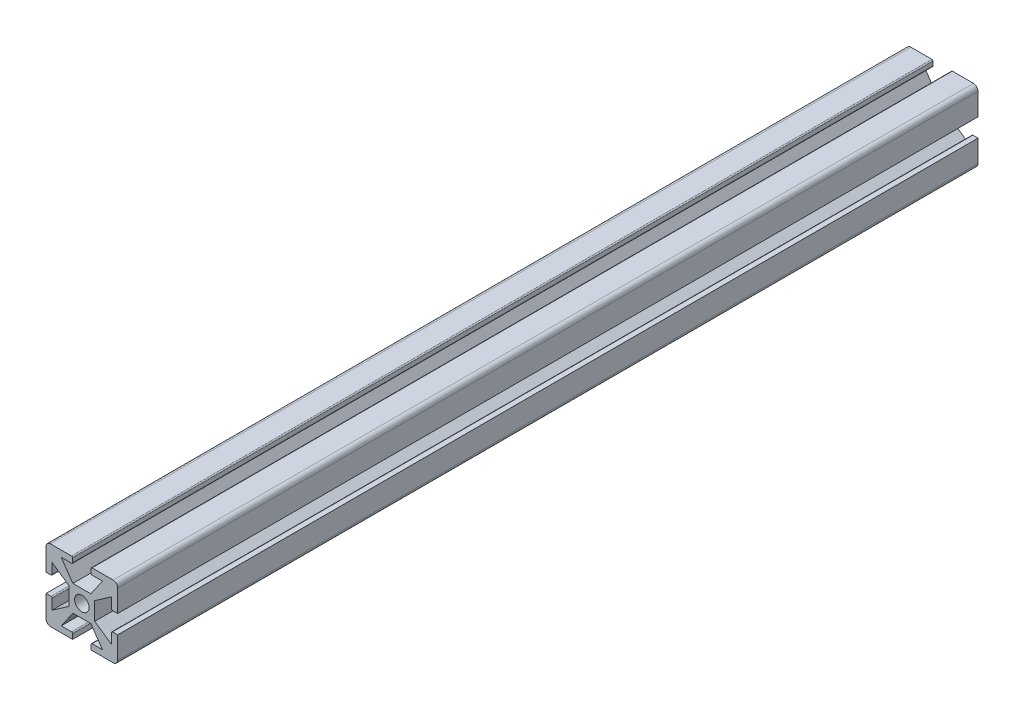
SolidWorks part; units mm, degrees
ref_plane "Front Plane" through (0, 0, 0) normal (0, 0, 1) x (1, 0, 0)
ref_plane "Top Plane" through (0, 0, 0) normal (0, 1, 0) x (1, 0, 0)
ref_plane "Right Plane" through (0, 0, 0) normal (1, 0, 0) x (0, 0, -1)
sketch "Sketch1" plane through (0, 0, 0) normal (0, 0, 1) x (1, 0, 0)
  line L1 (-12.7, -12.7) -> (12.7, -12.7)
  line L2 (-12.7, -12.7) -> (-12.7, 12.7)
  line L3 (-12.7, 12.7) -> (12.7, 12.7)
  line L4 (12.7, -12.7) -> (12.7, 12.7)
  line L5 (-12.7, -12.7) -> (12.7, 12.7) construction
  line L6 (-12.7, 12.7) -> (12.7, -12.7) construction
  point P0 (0, 0)
extrude "Boss-Extrude1" add sketch "Sketch1" along normal blind 304.8
fillet "Fillet1" radius 1.5875 4 edges at (-12.7, -12.7, 152.4) (12.7, -12.7, 152.4) (-12.7, 12.7, 152.4) (12.7, 12.7, 152.4)
other "Hole1"
sketch "Sketch6" plane through (0, 0, 304.8) normal (0, 0, 1) x (1, 0, 0)
  circle A0 centre (0, -0.0488) radius 2.5527
  dimension "D1" = 5.1054
sketch "Sketch7" plane through (0, 0, 304.8) normal (0, 0, 1) x (1, 0, 0)
  line L0 (11.1125, 12.7) -> (-11.1125, 12.7) construction
  line L1 (-3.2639, 10.4648) -> (3.2639, 10.4648) construction
  line L2 (-3.2639, 10.4648) -> (-3.2639, 12.7)
  line L3 (-3.2639, 12.7) -> (3.2639, 12.7)
  line L4 (3.2639, 10.4648) -> (3.2639, 12.7)
  line L5 (-3.2639, 10.4648) -> (3.2639, 12.7) construction
  line L6 (-3.2639, 12.7) -> (3.2639, 10.4648) construction
  line L7 (-7.3025, 10.4648) -> (7.3025, 10.4648)
  line L8 (7.3025, 10.4648) -> (3.175, 4.5212)
  line L9 (3.175, 4.5212) -> (-3.175, 4.5212)
  line L10 (-3.175, 4.5212) -> (-7.3025, 10.4648)
  line L15 (6.35, 12.7) -> (-6.35, 12.7) construction
  point P0 (0, 11.5824)
  point P10 (0, 10.4648)
  point P12 (0, 12.7)
  point P13 (0, 12.7)
  point P14 (0, 4.5212)
  point P15 (0, 10.4648)
  point P18 (0, 12.7)
  dimension "D1" = 6.5278
  dimension "D2" = 2.2352
  dimension "D3" = 5.9436
  dimension "D4" = 14.605
  dimension "D5" = 6.35
extrude "Cut-Extrude2" cut sketch "Sketch7" against normal up to surface (304.8 mm away)
fillet "Fillet4" radius 0.3969 4 edges at (3.2639, 10.4648, 152.4) (3.2639, 12.7, 152.4) (-3.2639, 10.4648, 152.4) (-3.2639, 12.7, 152.4)
pattern_circular "CirPattern2" count 4 over 360 about axis through (0, -0.0488, 0) along (0, 0, 1) of "Fillet4", "Cut-Extrude2"
